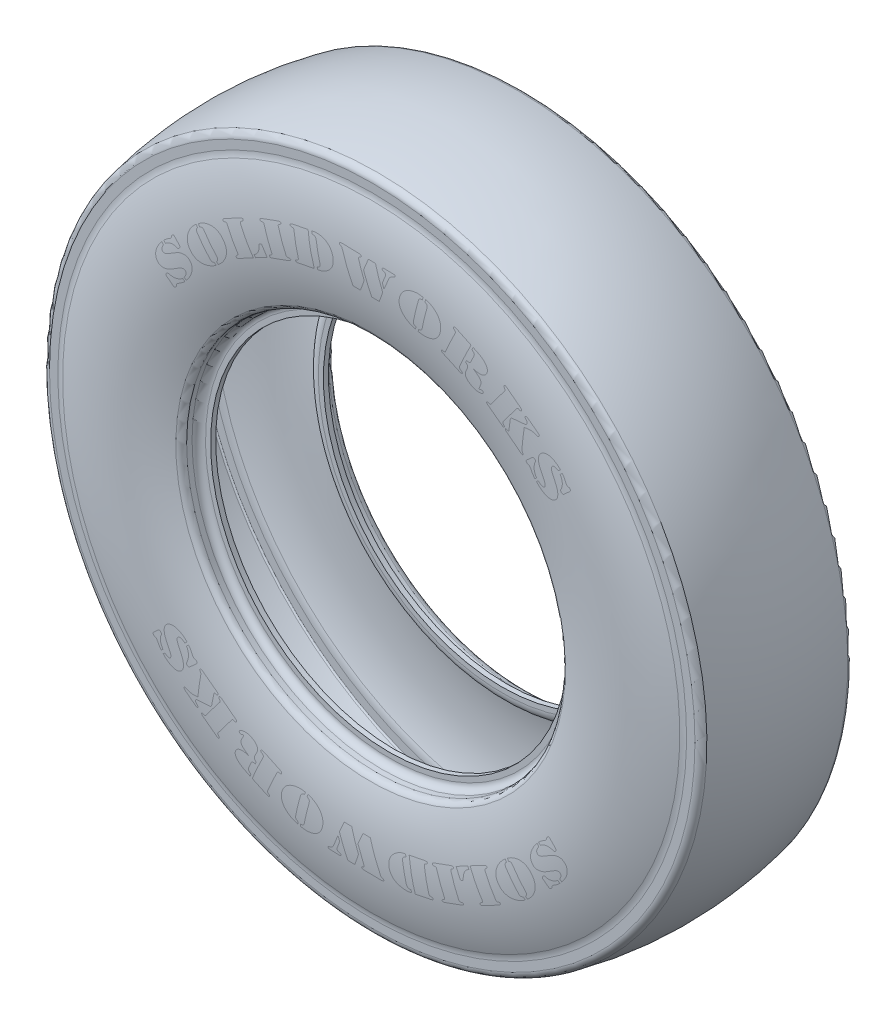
SolidWorks part; units mm, degrees
ref_plane "Front Plane" through (0, 0, 0) normal (0, 0, 1) x (1, 0, 0)
ref_plane "Top Plane" through (0, 0, 0) normal (0, 1, 0) x (1, 0, 0)
ref_plane "Right Plane" through (0, 0, 0) normal (1, 0, 0) x (0, 0, -1)
sketch "Sketch1" plane through (0, 0, 0) normal (1, 0, 0) x (0, 0, -1)
  line L0 (-45, 191.6638) -> (-45, 186.6849)
  line L1 (0, 0) -> (-59.0867, 0) construction
  line L2 (-42.2124, 113) -> (-39, 113)
  line L3 (0, 0) -> (0, 42.9018) construction
  line L4 (-35, 109) -> (-35, 106)
  arc A0 (0, 200) -> (-41.8367, 195.5753) centre (0, 0) ccw
  arc A1 (-45.6073, 183.2532) -> (-45.9845, 115.6693) centre (48.3199, 148.9359) ccw
  arc A2 (-41.8367, 195.5753) -> (-45, 191.6638) centre (-41, 191.6638) ccw
  arc A3 (-45.9845, 115.6693) -> (-42.2124, 113) centre (-42.2124, 117) ccw
  arc A4 (-39, 113) -> (-35, 109) centre (-39, 109) cw
  arc A5 (-45, 186.6849) -> (-45.6073, 183.2532) centre (-55, 186.6849) cw
  point P14 (-45, 194.8718)
  point P17 (-45, 113)
  point P20 (-35, 113)
  point P23 (-45, 184.8718)
  point P24 (-51.6801, 148.9359)
  dimension "D4" = 200
  dimension "D6" = 100
  dimension "D10" = 4
  dimension "D11" = 10
  dimension "D1" = 400
  dimension "D2" = 90
  dimension "D3" = 10
  dimension "D5" = 226
  dimension "D7" = 10
  dimension "D8" = 7
  dimension "D9" = 45
revolve "Revolve-Thin1" add sketch "Sketch1" angle 360 about L1
sketch "Sketch2" plane through (0, 0, 0) normal (0, 0, 1) x (1, 0, 0)
  arc A0 (140.2633, 0) -> (-140.2633, 0) centre (0, 0) ccw construction
  arc A1 (148.9359, 0) -> (-148.9359, 0) centre (0, 0) ccw construction
  text T0 "SOLIDWORKS" font "Stencil" height in points 72
mirror "Mirror1" about plane through (0, 200, 0) normal (0, 0, 1)
pattern_circular "CirPattern2" count 2 over 360
